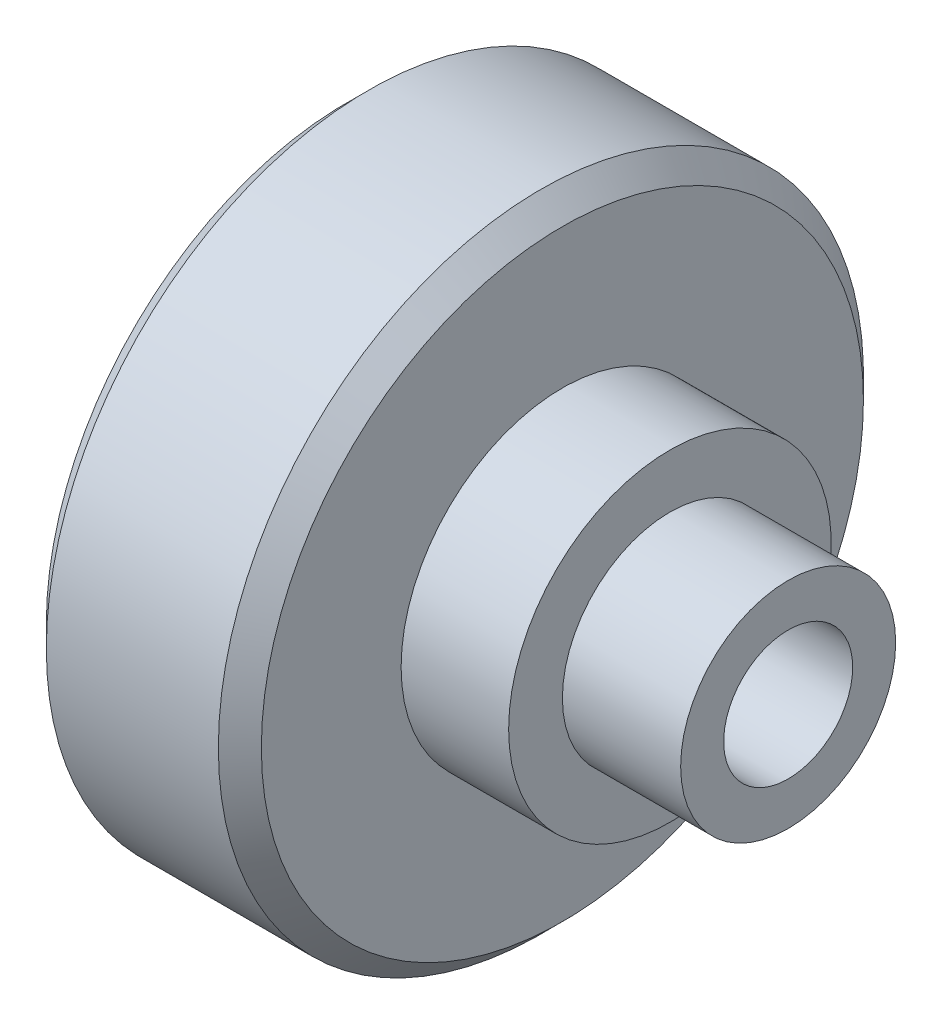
SolidWorks part; units mm, degrees
ref_plane "Front" through (0, 0, 0) normal (0, 0, 1) x (1, 0, 0)
ref_plane "Top" through (0, 0, 0) normal (0, 1, 0) x (1, 0, 0)
ref_plane "Right" through (0, 0, 0) normal (1, 0, 0) x (0, 0, -1)
sketch "Sketch1" plane through (0, 0, 0) normal (0, 1, 0) x (1, 0, 0)
  line L0 (0, 0) -> (20.5, 0)
  line L1 (20.5, 0) -> (20.5, 5)
  line L2 (20.5, 5) -> (15, 5)
  line L3 (15, 5) -> (15, 7.5)
  line L4 (15, 7.5) -> (10, 7.5)
  line L5 (10, 7.5) -> (10, 15)
  line L6 (10, 15) -> (0, 15)
  line L7 (0, 15) -> (0, 0)
revolve "Revolve1" add sketch "Sketch1" angle 360 about L0
sketch "Sketch2" plane through (20.5, 0, 0) normal (1, 0, 0) x (0, 0, -1)
  circle A0 centre (0, 0) radius 3
extrude "Cut-Extrude1" cut sketch "Sketch2" against normal through all
chamfer "Chamfer1" distance 1 angle 45 2 edges at (0, 0, 15) (10, 0, 15)
